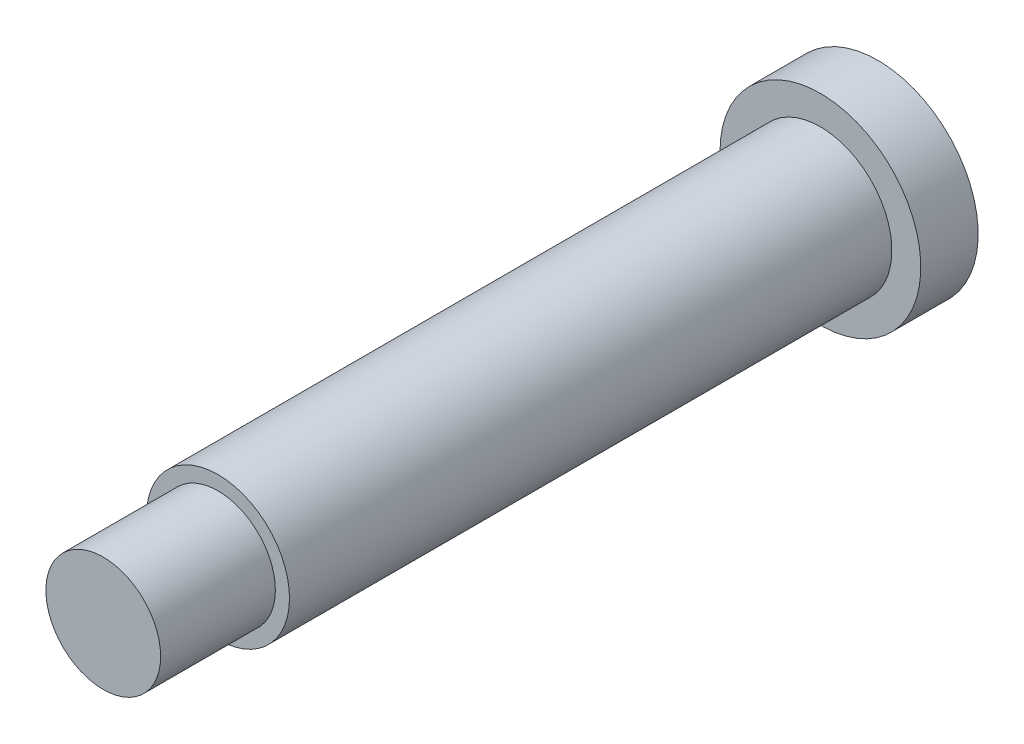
SolidWorks part; units mm, degrees
ref_plane "Front" through (0, 0, 0) normal (0, 0, 1) x (1, 0, 0)
ref_plane "Top" through (0, 0, 0) normal (0, 1, 0) x (1, 0, 0)
ref_plane "Right" through (0, 0, 0) normal (1, 0, 0) x (0, 0, -1)
sketch "Sketch1" plane through (0, 0, 0) normal (0, 0, 1) x (1, 0, 0)
  circle A0 centre (0, 0) radius 7.9121
  dimension "FirstOD" = 15.8242
extrude "Base-Extrude" add sketch "Sketch1" along normal blind 66.675
sketch "Sketch2" plane through (0, 0, 66.675) normal (0, 0, 1) x (1, 0, 0)
  circle A0 centre (0, 0) radius 6.35
  dimension "SecondOD" = 12.7
extrude "Boss-Extrude1" add sketch "Sketch2" along normal blind 12.7
sketch "Sketch3" plane through (0, 0, 0) normal (0, 0, -1) x (-1, 0, 0)
  circle A0 centre (0, 0) radius 11.1125
  dimension "HeadOD" = 22.225
extrude "Boss-Extrude2" add sketch "Sketch3" along normal blind 6.35
